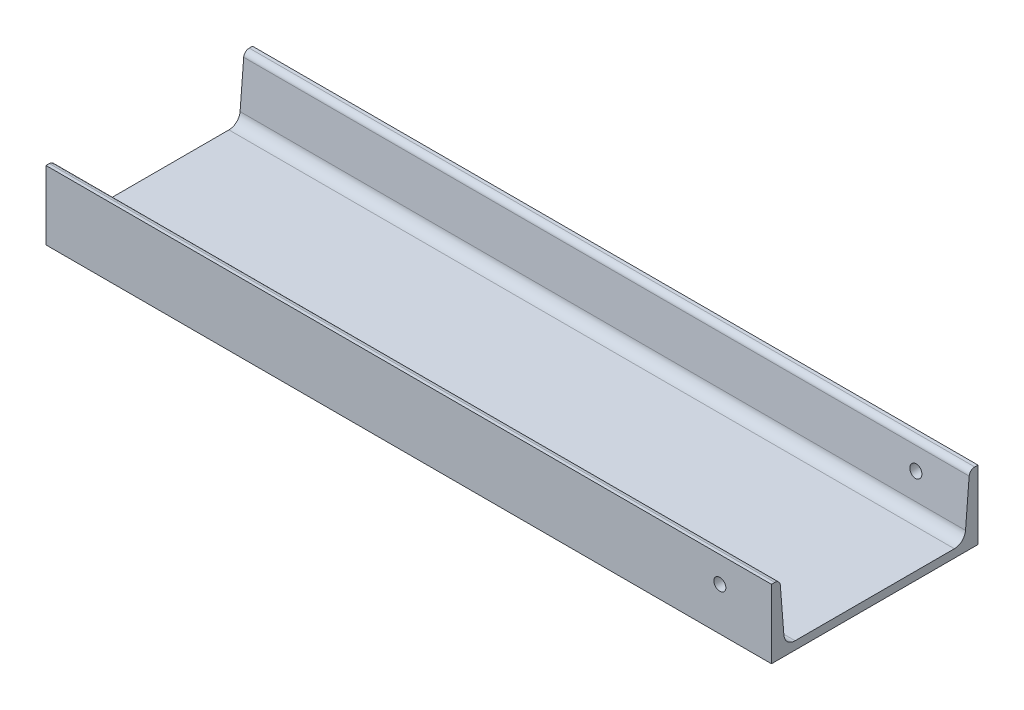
SolidWorks part; units mm, degrees
ref_plane "Plan1" through (0, 0, 0) normal (0, 0, 1) x (1, 0, 0)
ref_plane "Plan2" through (0, 0, 0) normal (0, 1, 0) x (1, 0, 0)
ref_plane "Plan3" through (0, 0, 0) normal (1, 0, 0) x (0, 0, -1)
sketch "Esquisse1" plane through (0, 0, 0) normal (1, 0, 0) x (0, 0, -1)
  line L0 (0, 0) -> (0, 80) construction
  line L1 (-120, 0) -> (120, 0)
  line L2 (120, 0) -> (120, 80)
  line L3 (120, 80) -> (116.1984, 80)
  line L4 (109.7191, 74.0179) -> (105.5184, 21.4642)
  line L5 (92.5597, 9.5) -> (-92.5597, 9.5)
  line L6 (-109.7191, 74.0179) -> (-105.5184, 21.4642)
  line L7 (-120, 80) -> (-116.1984, 80)
  line L8 (-120, 0) -> (-120, 80)
  line L10 (120, 40) -> (107, 40) construction
  arc A0 (105.5184, 21.4642) -> (92.5597, 9.5) centre (92.5597, 22.5) cw
  arc A1 (116.1984, 80) -> (109.7191, 74.0179) centre (116.1984, 73.5) ccw
  arc A2 (-116.1984, 80) -> (-109.7191, 74.0179) centre (-116.1984, 73.5) cw
  arc A3 (-105.5184, 21.4642) -> (-92.5597, 9.5) centre (-92.5597, 22.5) ccw
  point P18 (0, 9.5)
  dimension "R" = 13
  dimension "r1" = 6.5
  dimension "A" = 9.5
  dimension "D3" = 4.57
  dimension "B" = 80
  dimension "H" = 240
  dimension "A1" = 13
extrude "Base-Extrusion" add sketch "Esquisse1" along normal blind 843
sketch "Esquisse2" plane through (0, 0, 120) normal (0, 0, 1) x (1, 0, 0)
  line L2 (843, 80) -> (843, 0) construction
  line L3 (843, 80) -> (0, 80) construction
  circle A1 centre (783, 50) radius 7
  dimension "D1" = 60
  dimension "D2" = 14
  dimension "D3" = 30
extrude "Enlèv. mat.-Extru.1" cut sketch "Esquisse2" against normal through all
